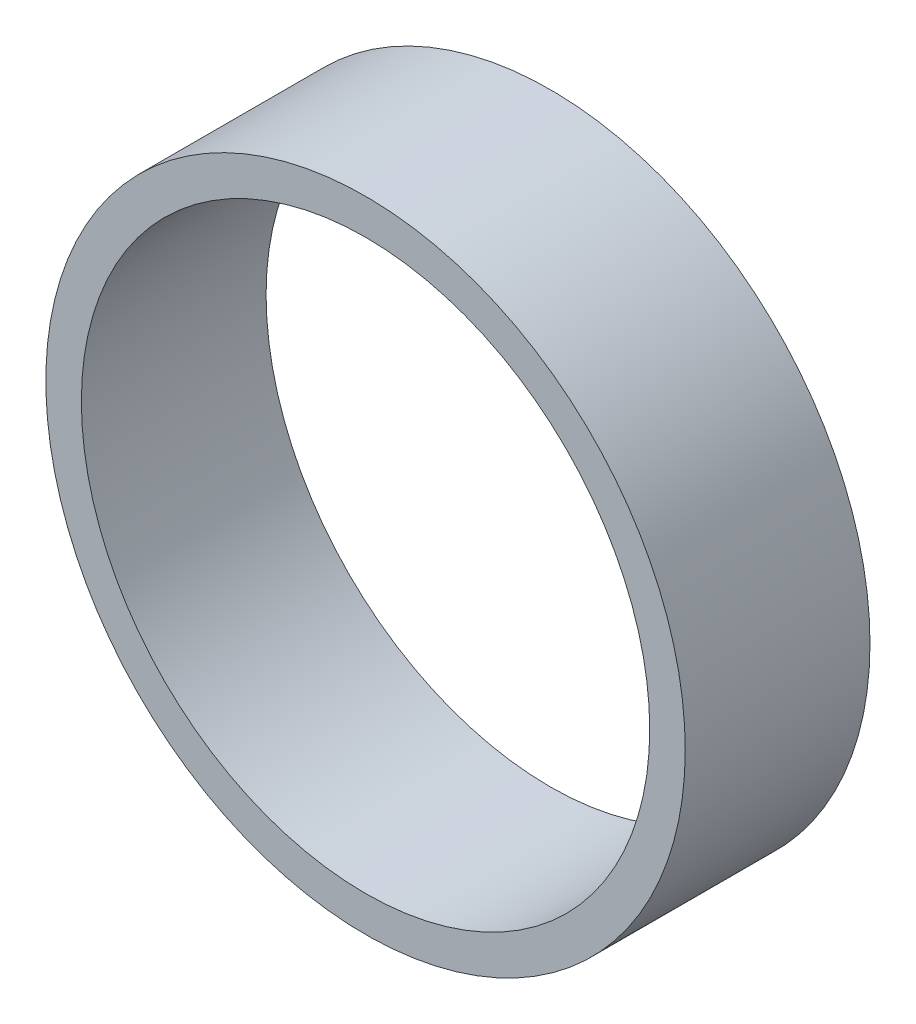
SolidWorks part; units mm, degrees
ref_plane "Plan de face" through (0, 0, 0) normal (0, 0, 1) x (1, 0, 0)
ref_plane "Plan de dessus" through (0, 0, 0) normal (0, 1, 0) x (1, 0, 0)
ref_plane "Plan de droite" through (0, 0, 0) normal (1, 0, 0) x (0, 0, -1)
sketch "Esquisse1" plane through (0, 0, 0) normal (0, 0, 1) x (1, 0, 0)
  circle A0 centre (0, 0) radius 22.5
  dimension "D1" = 45
extrude "Extru.-Mince1" add sketch "Esquisse1" against normal blind 13 thin
